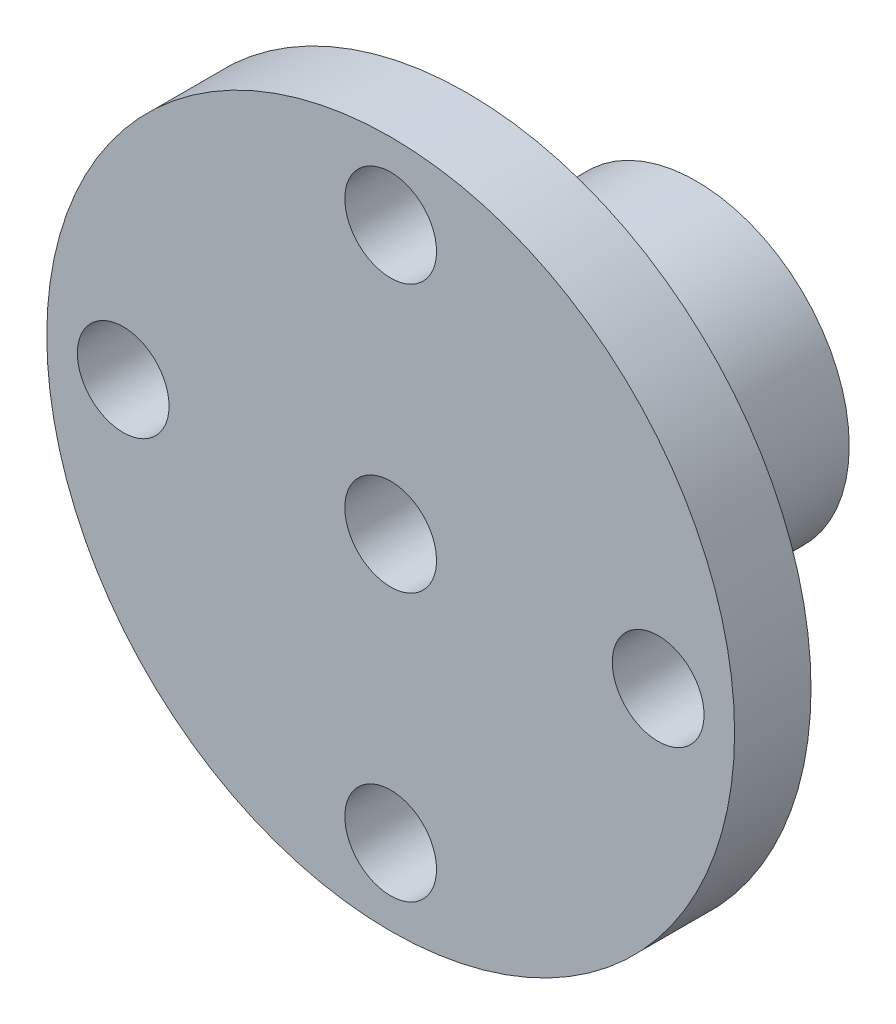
SolidWorks part; units mm, degrees
ref_plane "Front Plane" through (0, 0, 0) normal (0, 0, 1) x (1, 0, 0)
ref_plane "Top Plane" through (0, 0, 0) normal (0, 1, 0) x (1, 0, 0)
ref_plane "Right Plane" through (0, 0, 0) normal (1, 0, 0) x (0, 0, -1)
sketch "Sketch1" plane through (0, 0, 0) normal (0, 0, 1) x (1, 0, 0)
  line L0 (0, 22.5) -> (0, -22.5) construction
  line L1 (-22.5, 0) -> (22.5, 0) construction
  circle A0 centre (0, 0) radius 22.5
  circle A1 centre (0, 0) radius 17.5 construction
  circle A3 centre (0, 17.5067) radius 3
  circle A4 centre (17.5, 0) radius 3
  circle A5 centre (0, -17.5) radius 3
  circle A6 centre (-17.5, 0) radius 3
  dimension "D1" = 45
  dimension "D2" = 35
  dimension "D4" = 6
  dimension "D5" = 6
  dimension "D6" = 6
  dimension "D7" = 6
extrude "Boss-Extrude1" add sketch "Sketch1" along normal blind 5
sketch "Sketch2" plane through (0, 0, 0) normal (0, 0, -1) x (-1, 0, 0)
  circle A0 centre (0, 0) radius 10
  dimension "D1" = 20
extrude "Boss-Extrude2" add sketch "Sketch2" along normal blind 15 contours A0
sketch "Sketch3" plane through (0, 0, -15) normal (0, 0, -1) x (-1, 0, 0)
  circle A0 centre (0, 0) radius 3
  dimension "D1" = 6
extrude "Cut-Extrude1" cut sketch "Sketch3" against normal blind 20
